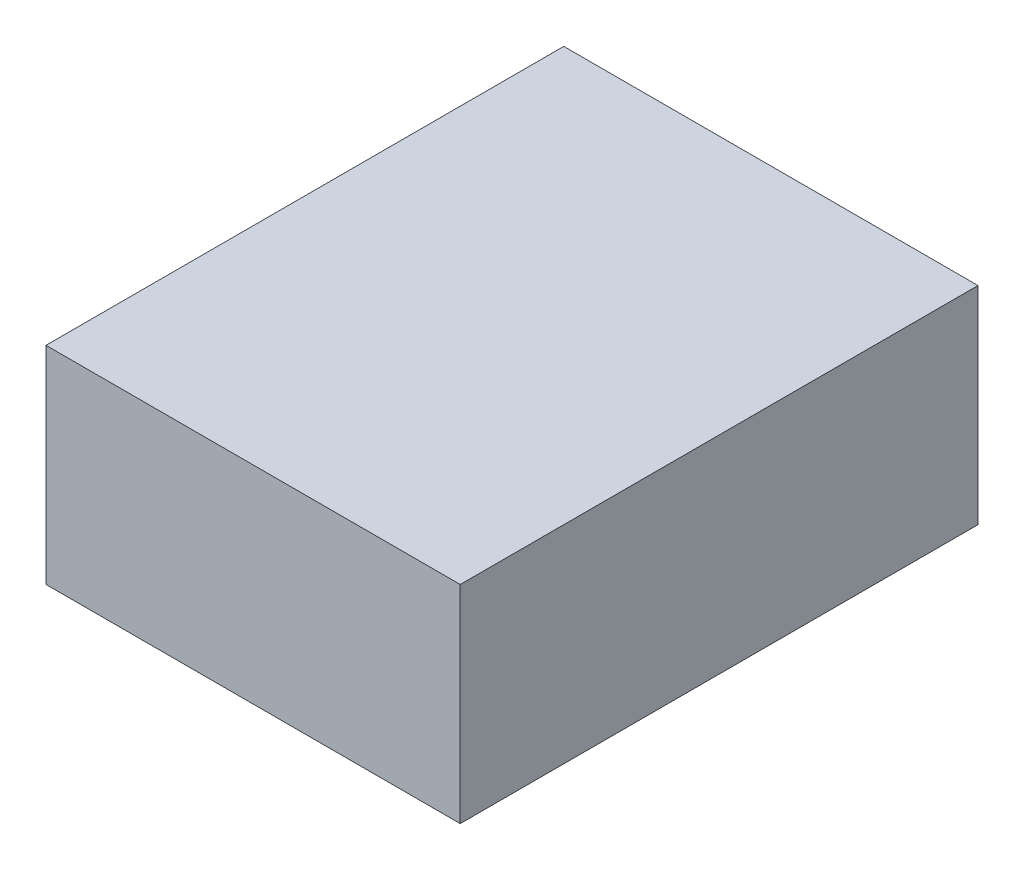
SolidWorks part; units mm, degrees
ref_plane "Front Plane" through (0, 0, 0) normal (0, 0, 1) x (1, 0, 0)
ref_plane "Top Plane" through (0, 0, 0) normal (0, 1, 0) x (1, 0, 0)
ref_plane "Right Plane" through (0, 0, 0) normal (1, 0, 0) x (0, 0, -1)
sketch "Sketch1" plane through (0, 0, 0) normal (0, 0, 1) x (1, 0, 0)
  line L0 (-50.8, 25.4) -> (50.8, -25.4) construction
  line L1 (-50.8, 25.4) -> (50.8, 25.4)
  line L2 (-50.8, 25.4) -> (-50.8, -25.4)
  line L3 (-50.8, -25.4) -> (50.8, -25.4)
  line L4 (50.8, 25.4) -> (50.8, -25.4)
  dimension "D1" = 101.6
  dimension "D2" = 50.8
extrude "Extrude1" add sketch "Sketch1" along normal mid plane 127
